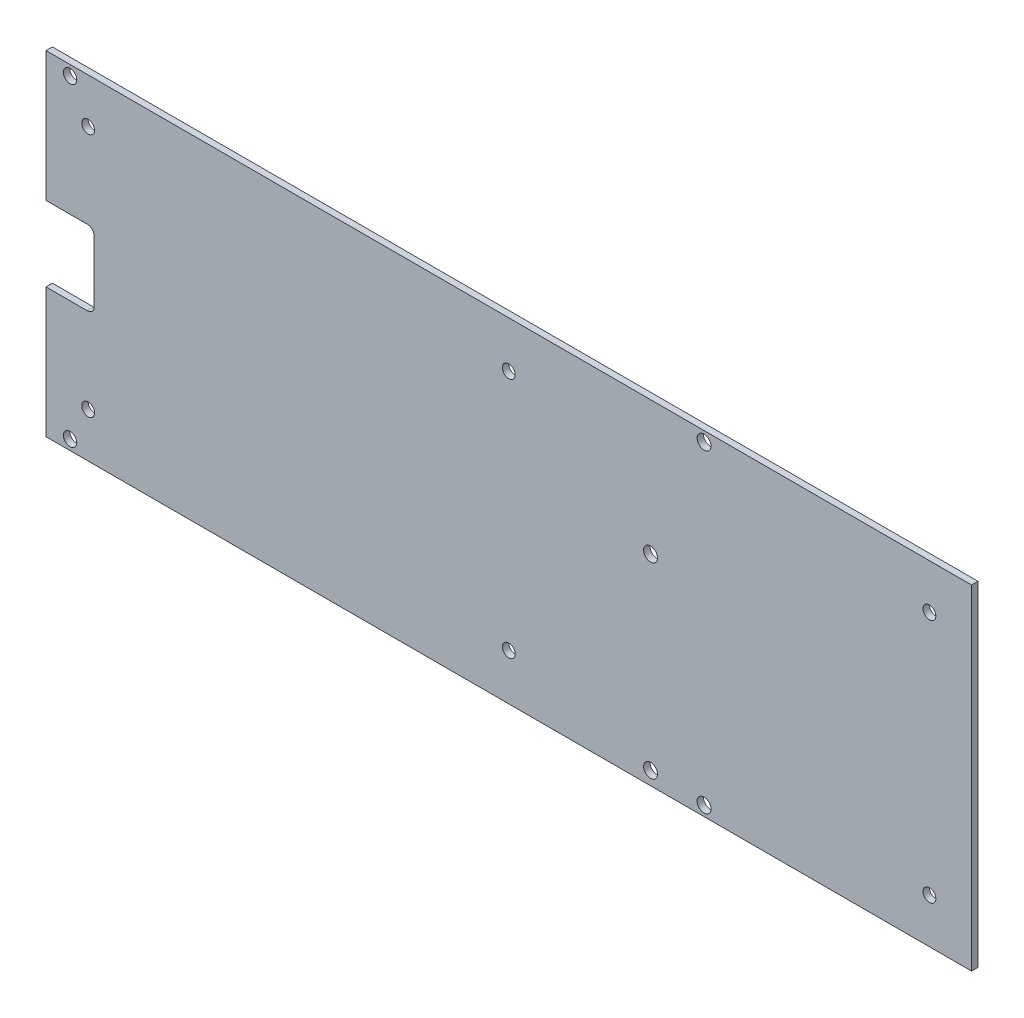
SolidWorks part; units mm, degrees
ref_plane "Front Plane" through (0, 0, 0) normal (0, 0, 1) x (1, 0, 0)
ref_plane "Top Plane" through (0, 0, 0) normal (0, 1, 0) x (1, 0, 0)
ref_plane "Right Plane" through (0, 0, 0) normal (1, 0, 0) x (0, 0, -1)
sketch "Sketch1" plane through (0, 0, 0) normal (0, 0, 1) x (1, 0, 0)
  line L1 (0, 0) -> (219.71, 0)
  line L2 (0, 0) -> (0, 79.375)
  line L3 (0, 79.375) -> (219.71, 79.375)
  line L4 (219.71, 0) -> (219.71, 79.375)
  dimension "D1" = 79.375
  dimension "D2" = 219.71
extrude "Extrude1" add sketch "Sketch1" along normal blind 1.524
sketch "Sketch2" plane through (0, 0, 1.524) normal (0, 0, 1) x (1, 0, 0)
  line L0 (109.855, 68.3895) -> (109.855, 10.9855) construction
  line L2 (0, 0) -> (219.71, 0) construction
  line L3 (219.71, 0) -> (219.71, 79.375) construction
  line L7 (219.71, 39.6875) -> (0, 39.6875) construction
  line L8 (0, 79.375) -> (0, 0) construction
  circle A0 centre (209.7024, 68.7451) radius 1.524
  circle A1 centre (109.855, 68.3895) radius 1.524
  circle A2 centre (109.855, 10.9855) radius 1.524
  circle A3 centre (209.7024, 10.6299) radius 1.524
  circle A4 centre (10.0076, 10.6299) radius 1.524
  circle A5 centre (10.0076, 68.7451) radius 1.524
  circle A6 centre (156.21, 76.9937) radius 1.651
  circle A7 centre (156.21, 2.3813) radius 1.651
  circle A8 centre (5.715, 76.9937) radius 1.5875
  circle A9 centre (5.715, 2.3812) radius 1.5875
  circle A10 centre (143.51, 47.625) radius 1.651
  circle A11 centre (143.51, 3.175) radius 1.651
  dimension "D1" = 3.048
  dimension "D2" = 10.0076
  dimension "D3" = 57.404
  dimension "D4" = 58.1152
  dimension "D5" = 109.855
  dimension "D6" = 74.6125
  dimension "D7" = 3.302
  dimension "D9" = 3.175
  dimension "D8" = 63.5
  dimension "D10" = 150.495
  dimension "D11" = 44.45
  dimension "D12" = 3.175
  dimension "D13" = 76.2
extrude "thru_holes" cut sketch "Sketch2" against normal through all
sketch "Sketch4" plane through (0, 0, 1.524) normal (0, 0, 1) x (1, 0, 0)
  line L1 (0, 39.6875) -> (17.381, 39.6875) construction
  line L2 (0, 79.375) -> (0, 0) construction
  line L3 (0, 30.7975) -> (0, 48.5775)
  line L4 (0, 48.5775) -> (9.8425, 48.5775)
  line L5 (11.43, 46.99) -> (11.43, 32.385)
  line L7 (0, 30.7975) -> (9.8425, 30.7975)
  arc A0 (9.8425, 48.5775) -> (11.43, 46.99) centre (9.8425, 46.99) cw
  arc A1 (9.8425, 30.7975) -> (11.43, 32.385) centre (9.8425, 32.385) ccw
  point P8 (11.43, 39.6875)
  point P11 (11.43, 48.5775)
  point P14 (11.43, 30.7975)
  dimension "D3" = 1.5875
  dimension "D1" = 8.89
  dimension "D2" = 11.43
extrude "notch" cut sketch "Sketch4" against normal blind 2.54
